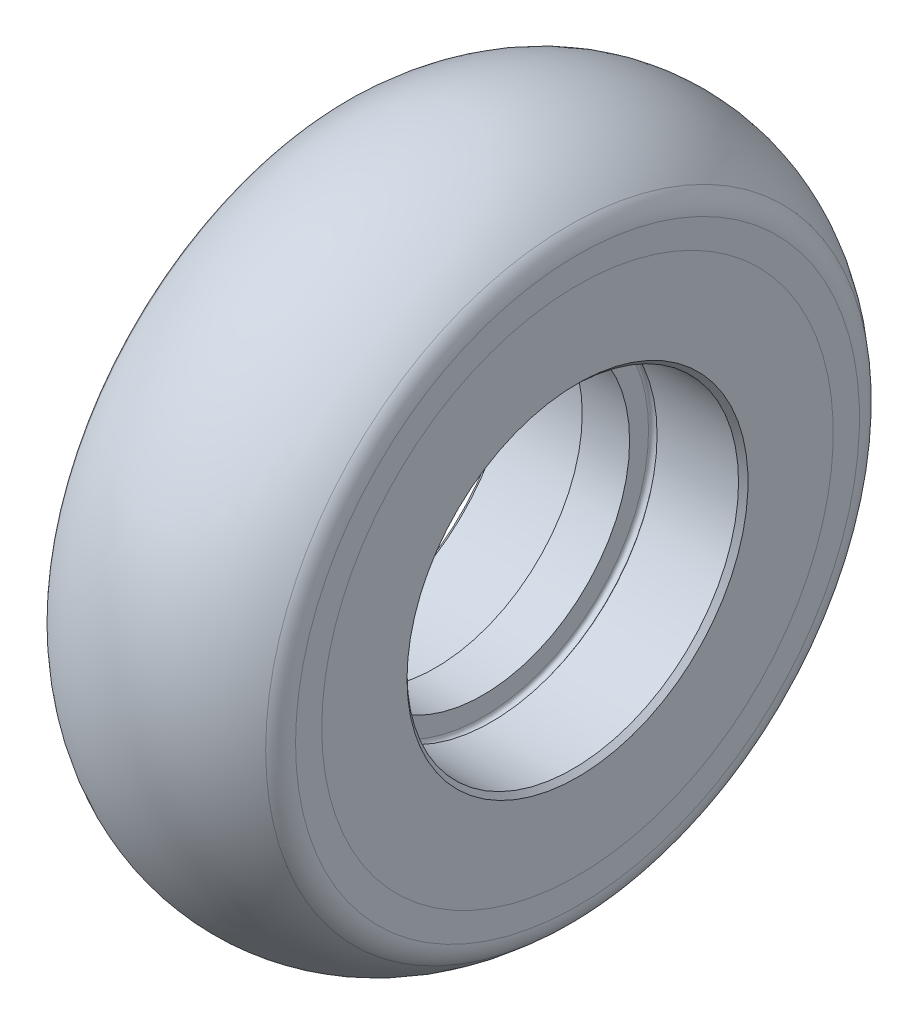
SolidWorks part; units mm, degrees
ref_plane "前视基准面" through (0, 0, 0) normal (0, 0, 1) x (1, 0, 0)
ref_plane "上视基准面" through (0, 0, 0) normal (0, 1, 0) x (1, 0, 0)
ref_plane "右视基准面" through (0, 0, 0) normal (1, 0, 0) x (0, 0, -1)
sketch "草图1" plane through (0, 0, 0) normal (0, 1, 0) x (1, 0, 0)
  line L0 (-16.4076, 0) -> (16.4076, 0) construction
  line L1 (-12.5, 27) -> (-12.5, 18)
  line L2 (12.5, 18) -> (12.5, 27)
  line L3 (-2.5, 15.5) -> (2.5, 15.5)
  line L4 (-2.5, 17.5) -> (-2.5, 15.5)
  line L5 (-12, 17.5) -> (-3.4012, 17.5)
  line L6 (-12.5, 18) -> (-12, 17.5)
  line L7 (12, 17.5) -> (12.5, 18)
  line L8 (-3.4012, 17.5) -> (-3.2192, 17.741)
  line L9 (2.5, 17.5) -> (2.5, 15.5)
  line L10 (12, 17.5) -> (3.4012, 17.5)
  line L11 (3.4012, 17.5) -> (3.2192, 17.741)
  line L12 (-12, 27.5) -> (-12.5, 27)
  line L13 (12, 27.5) -> (12.5, 27)
  line L14 (-8.4367, 27.5) -> (-12, 27.5)
  line L15 (4.0633, 30.5) -> (-4.0633, 30.5)
  line L16 (12, 27.5) -> (8.4367, 27.5)
  line L17 (-5.5997, 29.7804) -> (-6.9003, 28.2196)
  line L18 (5.5997, 29.7804) -> (6.9003, 28.2196)
  arc A0 (-2.5, 17.5) -> (-3.2192, 17.741) centre (-2.9, 17.5) ccw
  arc A1 (3.2192, 17.741) -> (2.5, 17.5) centre (2.9, 17.5) ccw
  arc A2 (-8.4367, 27.5) -> (-6.9003, 28.2196) centre (-8.4367, 29.5) ccw
  arc A3 (-4.0633, 30.5) -> (-5.5997, 29.7804) centre (-4.0633, 28.5) ccw
  arc A4 (6.9003, 28.2196) -> (8.4367, 27.5) centre (8.4367, 29.5) ccw
  arc A5 (5.5997, 29.7804) -> (4.0633, 30.5) centre (4.0633, 28.5) ccw
revolve "旋转1" add sketch "草图1" angle 360 about L0
sketch "草图2" plane through (0, 0, 0) normal (0, 1, 0) x (1, 0, 0)
  line L0 (-16.4076, 0) -> (16.4076, 0) construction
  line L1 (-12, 27.5) -> (-12.5, 27)
  line L2 (12, 27.5) -> (12.5, 27)
  line L3 (-8.4367, 27.5) -> (-12, 27.5)
  line L4 (4.0633, 30.5) -> (-4.0633, 30.5)
  line L5 (12, 27.5) -> (8.4367, 27.5)
  line L6 (-5.5997, 29.7804) -> (-6.9003, 28.2196)
  line L7 (5.5997, 29.7804) -> (6.9003, 28.2196)
  line L8 (-12.5, 27) -> (-12.5, 29.767)
  line L9 (12.5, 27) -> (12.5, 29.767)
  arc A0 (-8.4367, 27.5) -> (-6.9003, 28.2196) centre (-8.4367, 29.5) ccw
  arc A1 (-4.0633, 30.5) -> (-5.5997, 29.7804) centre (-4.0633, 28.5) ccw
  arc A2 (6.9003, 28.2196) -> (8.4367, 27.5) centre (8.4367, 29.5) ccw
  arc A3 (5.5997, 29.7804) -> (4.0633, 30.5) centre (4.0633, 28.5) ccw
  arc A4 (11.5423, 31.9644) -> (-11.5423, 31.9644) centre (0, 19.5455) ccw
  arc A5 (12.5, 29.767) -> (11.5423, 31.9644) centre (9.5, 29.767) ccw
  arc A6 (-11.5423, 31.9644) -> (-12.5, 29.767) centre (-9.5, 29.767) ccw
revolve "旋转2" add sketch "草图2" angle 360 about L0
